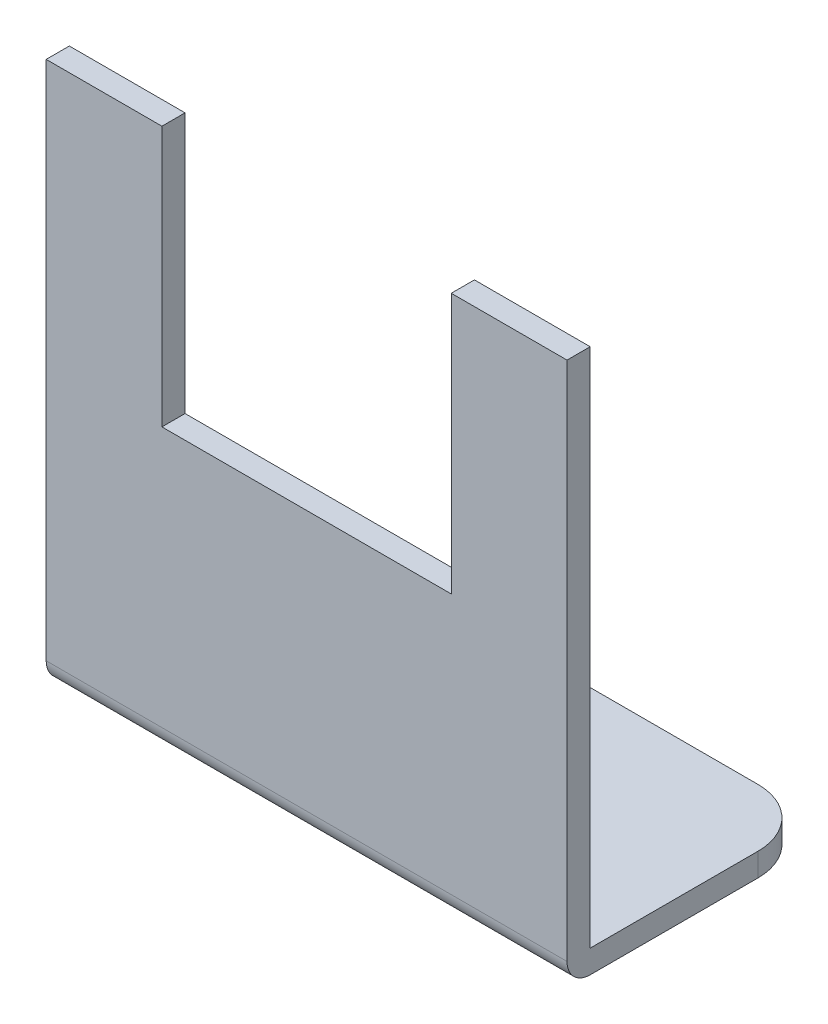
SolidWorks part; units mm, degrees
ref_plane "Front Plane" through (0, 0, 0) normal (0, 0, 1) x (1, 0, 0)
ref_plane "Top Plane" through (0, 0, 0) normal (0, 1, 0) x (1, 0, 0)
ref_plane "Right Plane" through (0, 0, 0) normal (1, 0, 0) x (0, 0, -1)
sketch "Sketch1" plane through (0, 0, 0) normal (0, 0, 1) x (1, 0, 0)
  line L1 (-22.5, 23.5) -> (22.5, 23.5)
  line L2 (-22.5, 23.5) -> (-22.5, -23.5)
  line L3 (-22.5, -23.5) -> (22.5, -23.5)
  line L4 (22.5, 23.5) -> (22.5, -23.5)
  line L5 (-22.5, 23.5) -> (22.5, -23.5) construction
  line L6 (-22.5, -23.5) -> (22.5, 23.5) construction
  point P0 (0, 0)
  dimension "D1" = 45
  dimension "D2" = 47
extrude "Boss-Extrude1" add sketch "Sketch1" along normal blind 2 contours L1 L4 L3 L2
sketch "Sketch2" plane through (0, 0, 0) normal (0, 0, -1) x (-1, 0, 0)
  line L0 (22.5, 23.5) -> (22.5, -23.5) construction
  line L1 (-22.5, -23.5) -> (22.5, -23.5)
  line L2 (-22.5, -23.5) -> (-22.5, -21.5)
  line L3 (-22.5, -21.5) -> (22.5, -21.5)
  line L4 (22.5, -23.5) -> (22.5, -21.5)
  dimension "D1" = 2
extrude "Boss-Extrude2" add sketch "Sketch2" along normal blind 19.5
fillet "Fillet1" radius 2 1 edges at (0, -23.5, 2)
fillet "Fillet2" radius 5 2 edges at (-22.5, -22.5, -19.5) (22.5, -22.5, -19.5)
sketch "Sketch3" plane through (0, 0, 2) normal (0, 0, 1) x (1, 0, 0)
  line L0 (-22.5, 23.5) -> (22.5, 23.5) construction
  line L1 (-12.5, 23.5) -> (12.5, 23.5)
  line L2 (-12.5, 23.5) -> (-12.5, 1)
  line L3 (-12.5, 1) -> (12.5, 1)
  line L4 (12.5, 23.5) -> (12.5, 1)
  point P6 (0, 23.5)
  dimension "D1" = 25
  dimension "D2" = 22.5
extrude "Cut-Extrude1" cut sketch "Sketch3" against normal through all contours L2 L3 L4 L1
sketch "Sketch4" plane through (0, -21.5, 0) normal (0, 1, 0) x (1, 0, 0)
  line L0 (-17.5, 19.5) -> (17.5, 19.5) construction
  circle A0 centre (0, 14.5) radius 1.5
  dimension "D1" = 3
  dimension "D2" = 5
extrude "Cut-Extrude2" cut sketch "Sketch4" against normal through all
equation "\"19.5.00mm\"=2"
